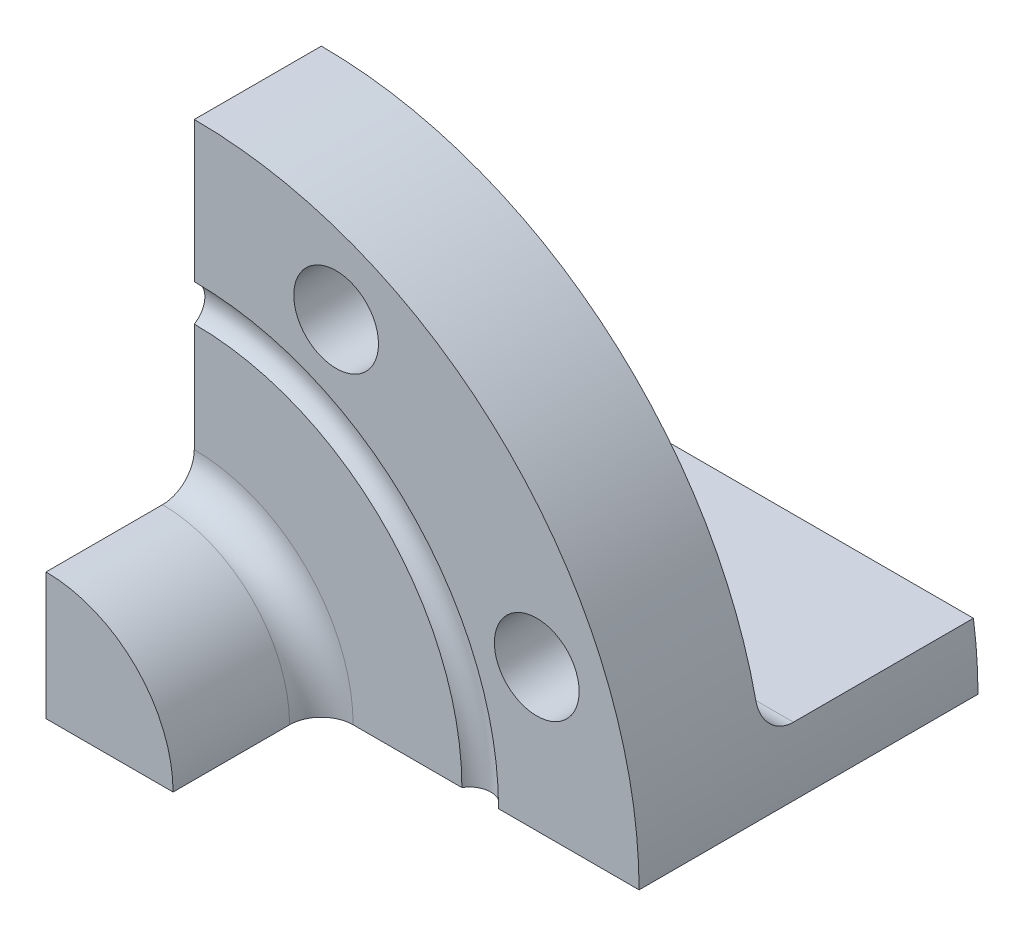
SolidWorks part; units mm, degrees
ref_plane "Ebene vorne" through (0, 0, 0) normal (0, 0, 1) x (1, 0, 0)
ref_plane "Ebene oben" through (0, 0, 0) normal (0, 1, 0) x (1, 0, 0)
ref_plane "Ebene rechts" through (0, 0, 0) normal (1, 0, 0) x (0, 0, -1)
sketch "Skizze1" plane through (0, 0, 0) normal (0, 0, 1) x (1, 0, 0)
  line L0 (0, -55) -> (0, 55) construction
  line L1 (55, 0) -> (-55, 0) construction
  line L2 (0, 0) -> (42, 0)
  line L3 (0, 42) -> (0, 0)
  line L5 (0, 0) -> (13.3939, 32.3358) construction
  line L6 (0, 0) -> (32.3358, 13.3939) construction
  arc A0 (0, 42) -> (42, 0) centre (0, 0) cw
  circle A1 centre (13.3939, 32.3358) radius 4
  circle A2 centre (32.3358, 13.3939) radius 4
  dimension "D1" = 42
  dimension "D2" = 35
  dimension "D3" = 8
  dimension "D4" = 22.5
  dimension "D5" = 22.5
extrude "Aufsatz-Linear austragen1" add sketch "Skizze1" against normal blind 12
sketch "Skizze2" plane through (0, 0, 0) normal (0, 0, 1) x (1, 0, 0)
  line L0 (6.6, 0) -> (-6.6, 0) construction
  line L1 (0, -6.6) -> (0, 6.6) construction
  line L2 (0, 12) -> (0, 0)
  line L3 (0, 0) -> (12, 0)
  arc A0 (12, 0) -> (0, 12) centre (0, 0) ccw
  dimension "D1" = 12
extrude "Aufsatz-Linear austragen2" add sketch "Skizze2" along normal blind 14 and the other way blind 2
fillet "Verrundung1" radius 3 1 edges at (8.4853, 8.4853, 0)
sketch "Skizze3" plane through (0, 0, -12) normal (0, 0, -1) x (-1, 0, 0)
  line L0 (-41.5692, 6) -> (0, 6)
  line L2 (0, 0) -> (0, 42)
  line L3 (-42, 0) -> (0, 0)
  line L4 (0, 0) -> (0, 6)
  line L5 (-42, 0) -> (0, 0)
  arc A1 (0, 42) -> (-42, 0) centre (0, 0) ccw
  arc A2 (-41.5692, 6) -> (-42, 0) centre (0, 0) ccw
  dimension "D2" = 6
  dimension "D1" = 0
extrude "Aufsatz-Linear austragen3" add sketch "Skizze3" along normal blind 20 and the other way blind 2
sketch "Skizze4" plane through (0, 0, 0) normal (0, 1, 0) x (1, 0, 0)
  line L0 (0, -23.1) -> (0, 23.1) construction
  circle A0 centre (0, 22) radius 7
  dimension "D1" = 14
  dimension "D2" = 22
extrude "Schnitt-Linear austragen1" cut sketch "Skizze4" against normal mid plane 20
fillet "Verrundung2" radius 3 1 edges at (20.7846, 6, -12)
sketch "Skizze6" plane through (0, 0, 0) normal (1, 0, 0) x (0, 0, -1)
  line L0 (-23.2126, 0) -> (43.1026, 0) construction
  line L1 (23.1, 0) -> (-23.1, 0) construction
  circle A0 centre (-1, 27) radius 2
  dimension "D1" = 4
  dimension "D2" = 54
  dimension "D3" = 1
revolve "Schnitt-Rotation1" cut sketch "Skizze6" angle 360 about L0
